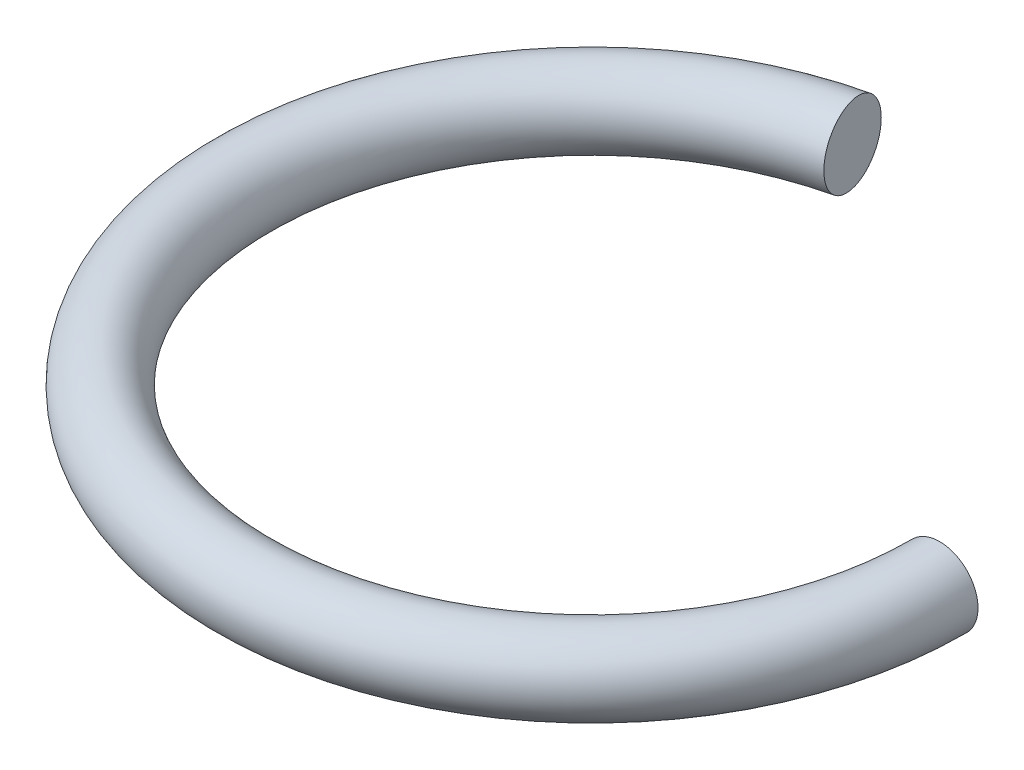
SolidWorks part; units mm, degrees
ref_plane "Plan de face" through (0, 0, 0) normal (0, 0, 1) x (1, 0, 0)
ref_plane "Plan de dessus" through (0, 0, 0) normal (0, 1, 0) x (1, 0, 0)
ref_plane "Plan de droite" through (0, 0, 0) normal (1, 0, 0) x (0, 0, -1)
sketch "Esquisse2" plane through (0, 0, 0) normal (0, 0, 1) x (1, 0, 0)
  line L0 (0.2037, -8.9924) -> (0.2037, -26.3706) construction
  arc A0 (11.4196, -13.2173) -> (-11.0121, -13.2173) centre (0.2037, -25.9924) ccw
  circle A1 centre (11.4196, -13.2173) radius 1.235
  dimension "D1" = 17
  dimension "D2" = 2.47
revolve "Révolution1" add sketch "Esquisse2" angle 257 about L0
